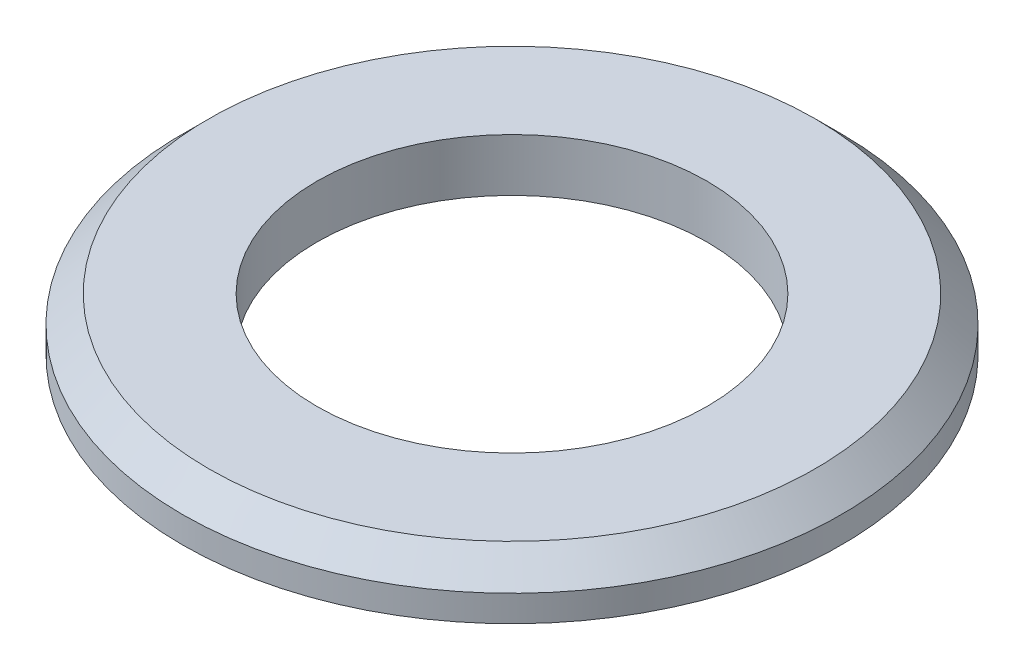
SolidWorks part; units mm, degrees
ref_plane "Front" through (0, 0, 0) normal (0, 0, 1) x (1, 0, 0)
ref_plane "Top" through (0, 0, 0) normal (0, 1, 0) x (1, 0, 0)
ref_plane "Right" through (0, 0, 0) normal (1, 0, 0) x (0, 0, -1)
sketch "Sketch1" plane through (0, 0, 0) normal (0, 1, 0) x (1, 0, 0)
  circle A0 centre (0, 0) radius 37
  circle A1 centre (0, 0) radius 62.5
extrude "Extrude1" add sketch "Sketch1" along normal blind 10
chamfer "Chamfer1" distance 5 1 edges at (0, 10, 62.5)
